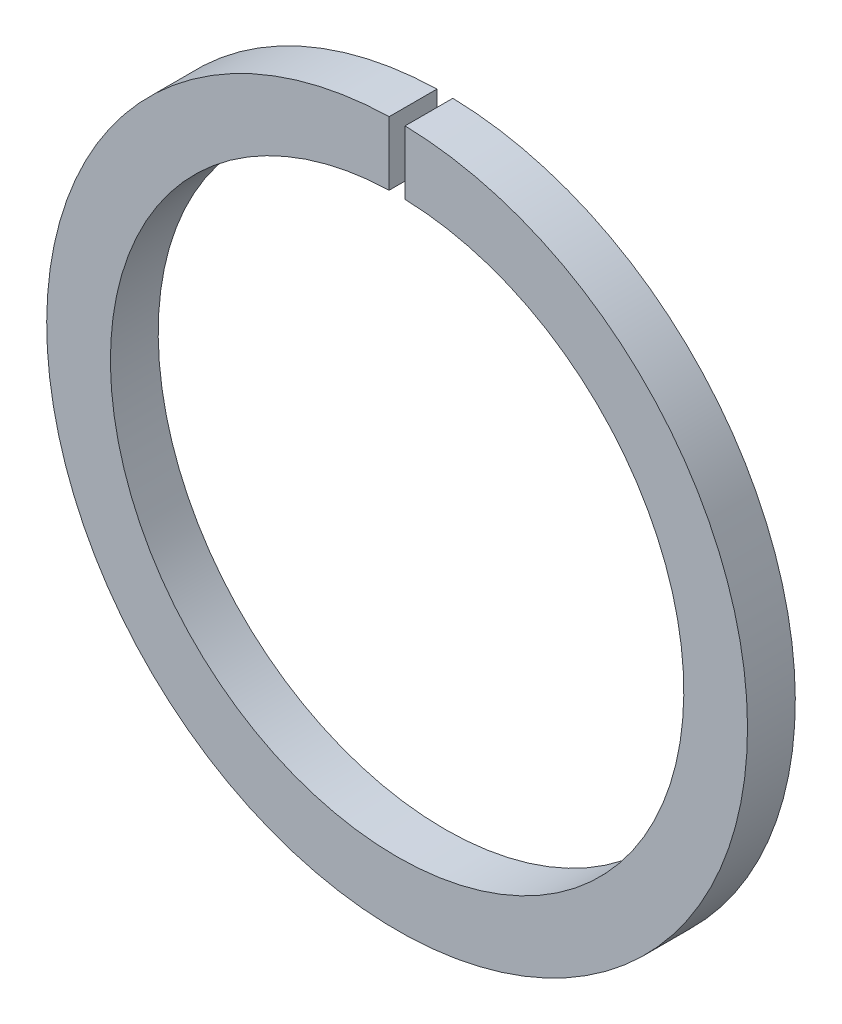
SolidWorks part; units mm, degrees
ref_plane "Face" through (0, 0, 0) normal (0, 0, 1) x (1, 0, 0)
ref_plane "Dessus" through (0, 0, 0) normal (0, 1, 0) x (1, 0, 0)
ref_plane "Droite" through (0, 0, 0) normal (1, 0, 0) x (0, 0, -1)
sketch "Esquisse1" plane through (0, 0, 0) normal (0, 0, 1) x (1, 0, 0)
  line L0 (-0.25, 8.9965) -> (-0.25, 10.9972)
  line L1 (0, 0) -> (0, 20.1283) construction
  line L2 (0.25, 8.9965) -> (0.25, 10.9972)
  arc A0 (-0.25, 10.9972) -> (0.25, 10.9972) centre (0, 0) ccw
  arc A1 (-0.25, 8.9965) -> (0.25, 8.9965) centre (0, 0) ccw
  dimension "D1" = 18
  dimension "D2" = 22
  dimension "D3" = 0.5
extrude "Extrusion1" add sketch "Esquisse1" along normal blind 1.5
